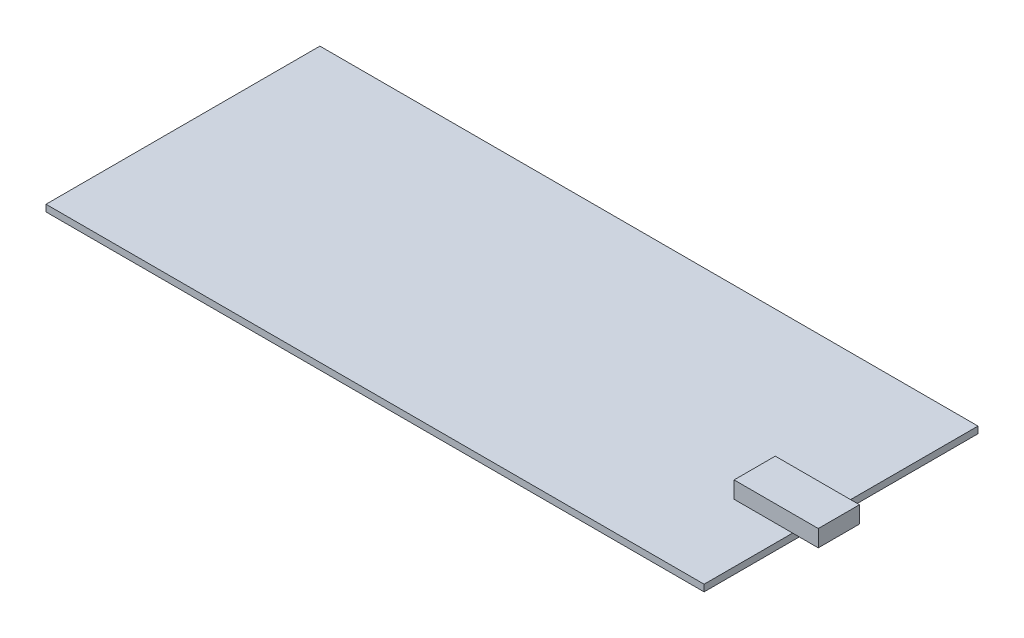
SolidWorks part; units mm, degrees
ref_plane "Front Plane" through (0, 0, 0) normal (0, 0, 1) x (1, 0, 0)
ref_plane "Top Plane" through (0, 0, 0) normal (0, 1, 0) x (1, 0, 0)
ref_plane "Right Plane" through (0, 0, 0) normal (1, 0, 0) x (0, 0, -1)
sketch "Sketch1" plane through (0, 0, 0) normal (0, 1, 0) x (1, 0, 0)
  line L1 (0, 81.99) -> (197, 81.99)
  line L2 (0, 81.99) -> (0, 0)
  line L3 (0, 0) -> (197, 0)
  line L4 (197, 81.99) -> (197, 0)
  point P4 (0, 0)
  dimension "D1" = 197
  dimension "D2" = 81.99
extrude "Boss-Extrude1" add sketch "Sketch1" along normal blind 2 contours L1 L4 L3 L2
sketch "Sketch2" plane through (0, 2, 0) normal (0, 1, 0) x (1, 0, 0)
  line L0 (0, 0) -> (197, 0) construction
  line L1 (179.4814, 38.825) -> (204.6777, 38.825)
  line L2 (179.4814, 38.825) -> (179.4814, 26.5)
  line L3 (179.4814, 26.5) -> (204.6777, 26.5)
  line L4 (204.6777, 38.825) -> (204.6777, 26.5)
  dimension "D1" = 26.5
  dimension "D2" = 12.325
extrude "Boss-Extrude2" add sketch "Sketch2" along normal blind 5.025
